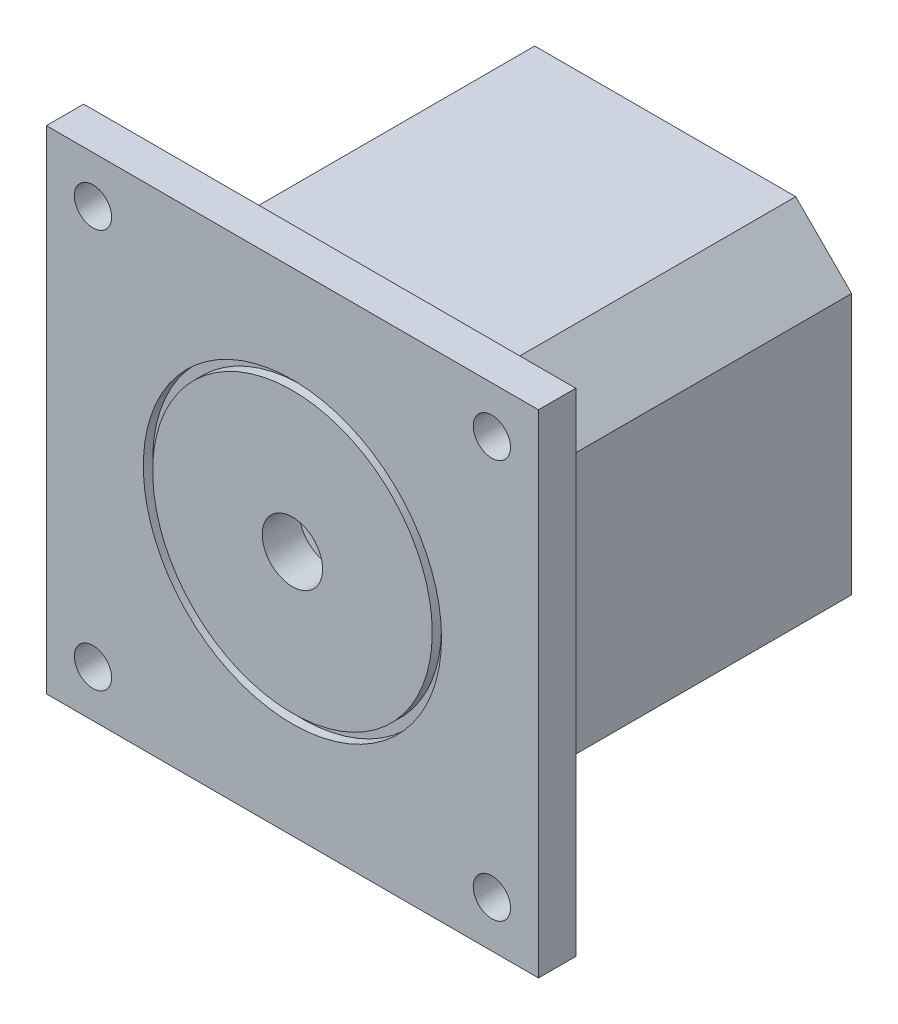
SolidWorks part; units mm, degrees
ref_plane "Front" through (0, 0, 0) normal (0, 0, 1) x (1, 0, 0)
ref_plane "Top" through (0, 0, 0) normal (0, 1, 0) x (1, 0, 0)
ref_plane "Right" through (0, 0, 0) normal (1, 0, 0) x (0, 0, -1)
sketch "Layout"
  dimension "D2" = 12.7
  dimension "D3" = 135
  dimension "CenterGear" = 38.1
  dimension "D1" = 157.6103
  dimension "Box" = 127
sketch "Sketch2"
  dimension "chamf" = 19.05
  dimension "D1" = 0
extrude "Base-Extrude" add sketch "Sketch2" along normal blind 127
shell "Shell1" thickness 6.35
sketch "Sketch3"
  dimension "D1" = 20.32
extrude "Boss-Extrude1" add sketch "Sketch3" against normal blind 12.7
sketch "Sketch4"
  dimension "D1" = 63.5
extrude "Cut-Extrude1" cut sketch "Sketch4" against normal up to next
sketch "Sketch5"
  dimension "D1" = 0.762
extrude "Cut-Extrude2" cut sketch "Sketch5" against normal up to next
sketch "Sketch7"
  dimension "D1" = 15.875
  dimension "D2" = 15.875
  dimension "D3" = 12.7
extrude "Cut-Extrude3" cut sketch "Sketch7" against normal through all
mirror "Mirror1"
mirror "Mirror2"
sketch "Sketch8"
  dimension "D1" = 101.6
extrude "Cut-Extrude-Thin1" cut sketch "Sketch8" against normal blind 3.175 thin
